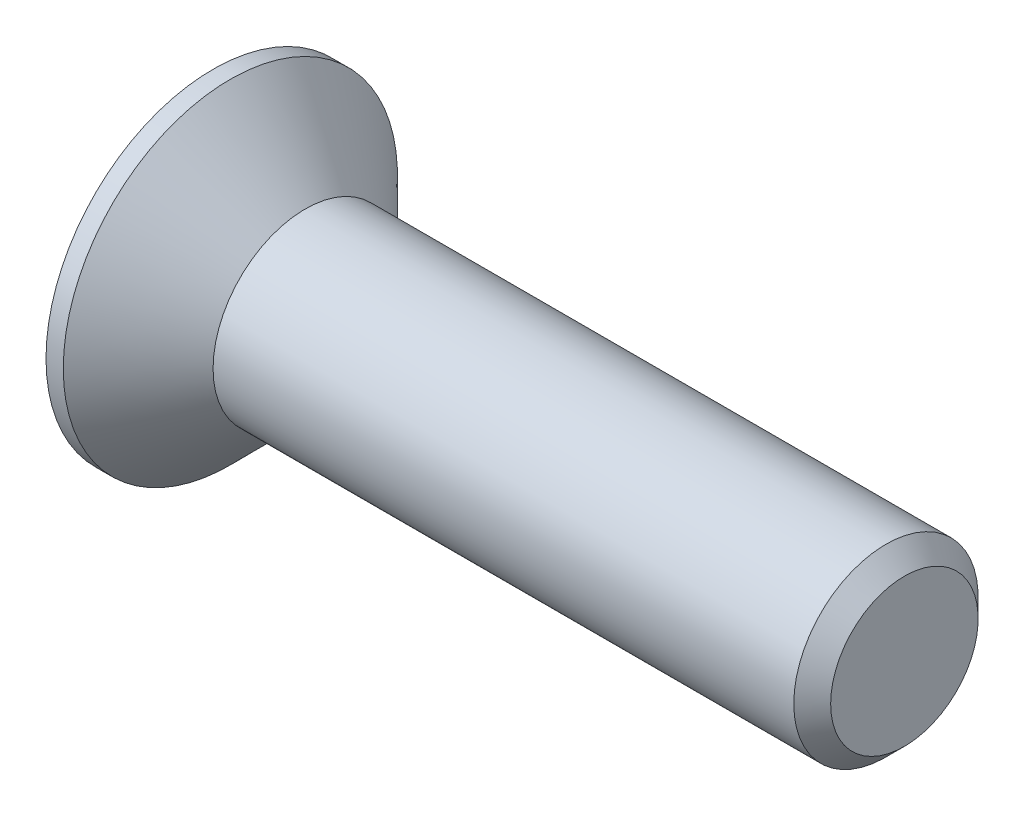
SolidWorks part; units mm, degrees
ref_plane "Front Plane" through (0, 0, 0) normal (0, 0, 1) x (1, 0, 0)
ref_plane "Top Plane" through (0, 0, 0) normal (0, 1, 0) x (1, 0, 0)
ref_plane "Right Plane" through (0, 0, 0) normal (1, 0, 0) x (0, 0, -1)
sketch "Sketch1" plane through (0, 0, 0) normal (0, 0, 1) x (1, 0, 0)
  line L1 (-4, 7.25) -> (-4, 0)
  line L2 (-4, 0) -> (26, 0)
  line L3 (26, 0) -> (26, 4)
  line L4 (26, 4) -> (0, 4)
  line L5 (-4, 7.25) -> (-3.25, 7.25)
  line L6 (-3.25, 7.25) -> (0, 4)
  dimension "D1" = 4
  dimension "D2" = 45
  dimension "D3" = 4
  dimension "D4" = 30
  dimension "D5" = 7.25
revolve "Revolve1" add sketch "Sketch1" angle 360 about L2
chamfer "Chamfer1" distance 0.8 angle 45 1 edges at (26, 0, 4)
sketch "Sketch2" plane through (-4, 0, 0) normal (-1, 0, 0) x (0, 0, 1)
  line L0 (-1.09, 4.35) -> (1.09, 4.35)
  line L1 (1.09, 4.35) -> (1.09, 1.09)
  line L2 (1.09, 1.09) -> (4.35, 1.09)
  line L3 (4.35, 1.09) -> (4.35, -1.09)
  line L4 (4.35, -1.09) -> (1.09, -1.09)
  line L5 (1.09, -1.09) -> (1.09, -4.35)
  line L6 (1.09, -4.35) -> (-1.09, -4.35)
  line L7 (-1.09, -4.35) -> (-1.09, -1.09)
  line L8 (-1.09, -1.09) -> (-4.35, -1.09)
  line L9 (-4.35, -1.09) -> (-4.35, 1.09)
  line L10 (-4.35, 1.09) -> (-1.09, 1.09)
  line L11 (-1.09, 1.09) -> (-1.09, 4.35)
  point P2 (0, 4.35)
  point P14 (0, -4.35)
  point P15 (4.35, 0)
  point P16 (-4.35, 0)
  dimension "D1" = 8.7
  dimension "D2" = 2.18
extrude "Cut-Extrude1" cut sketch "Sketch2" against normal blind 3.45
